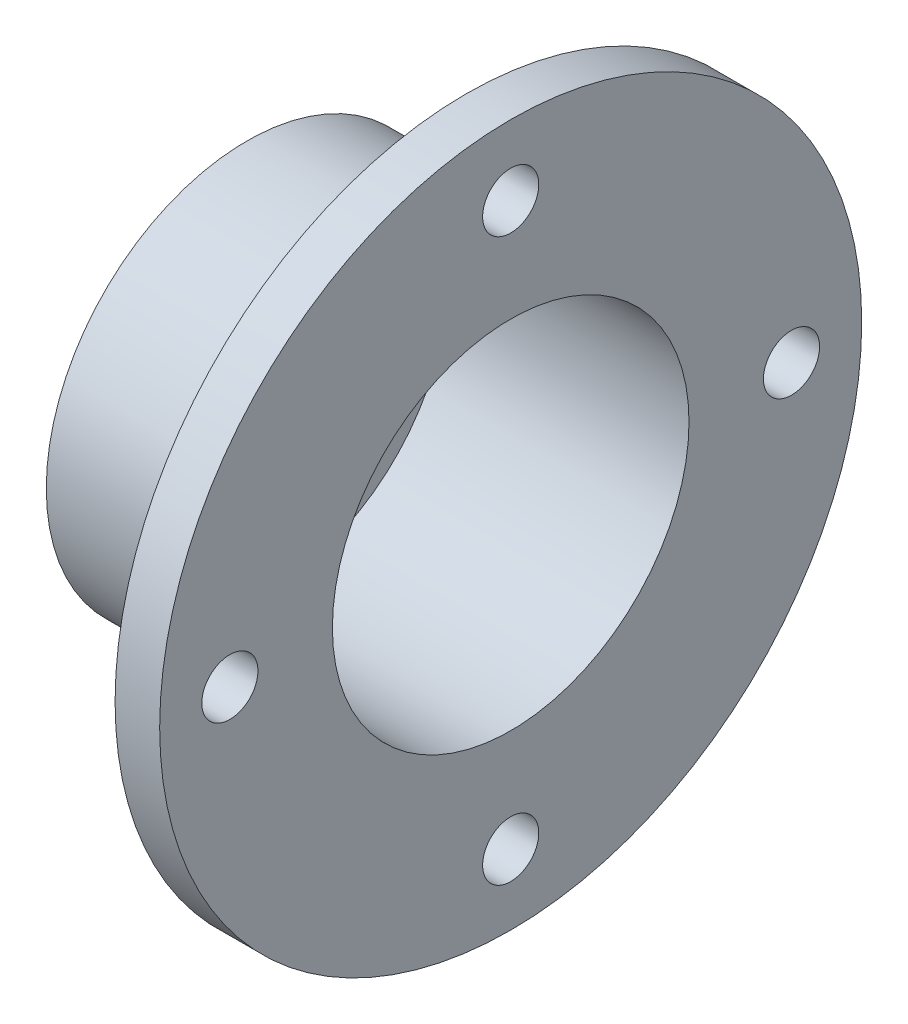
SolidWorks part; units mm, degrees
ref_plane "Front Plane" through (0, 0, 0) normal (0, 0, 1) x (1, 0, 0)
ref_plane "Top Plane" through (0, 0, 0) normal (0, 1, 0) x (1, 0, 0)
ref_plane "Right Plane" through (0, 0, 0) normal (1, 0, 0) x (0, 0, -1)
sketch "Sketch1" plane through (0, 0, 0) normal (0, 0, 1) x (1, 0, 0)
  line L0 (0, 0) -> (47.7844, 0) construction
  line L1 (0, 9.525) -> (0, 14.2875)
  line L2 (0, 14.2875) -> (15.6125, 14.2875)
  line L3 (15.6125, 14.2875) -> (15.6125, 25)
  line L4 (18.7875, 12.7) -> (1.5875, 12.7)
  line L5 (1.5875, 12.7) -> (1.5875, 9.525)
  line L6 (1.5875, 9.525) -> (0, 9.525)
  line L7 (15.6125, 25) -> (18.7875, 25)
  line L8 (18.7875, 25) -> (18.7875, 12.7)
  dimension "D1" = 3.175
  dimension "D2" = 1.5875
  dimension "D3" = 1.5875
  dimension "D4" = 3.175
  dimension "D5" = 17.2
  dimension "D6" = 12.7
  dimension "D7" = 25
revolve "Revolve1" add sketch "Sketch1" angle 360 about L0
sketch "Sketch2" plane through (15.6125, 0, 0) normal (-1, 0, 0) x (0, 0, 1)
  line L0 (0, 0) -> (0, 50000) construction
  line L1 (0, 0) -> (-50000, 0) construction
  circle A0 centre (0, 0) radius 20 construction
  circle A1 centre (0, 20) radius 2
  circle A2 centre (-20, 0) radius 2
  circle A3 centre (0, -20) radius 2
  circle A4 centre (20, 0) radius 2
  dimension "D1" = 40
  dimension "D2" = 4
extrude "Cut-Extrude1" cut sketch "Sketch2" against normal up to next
